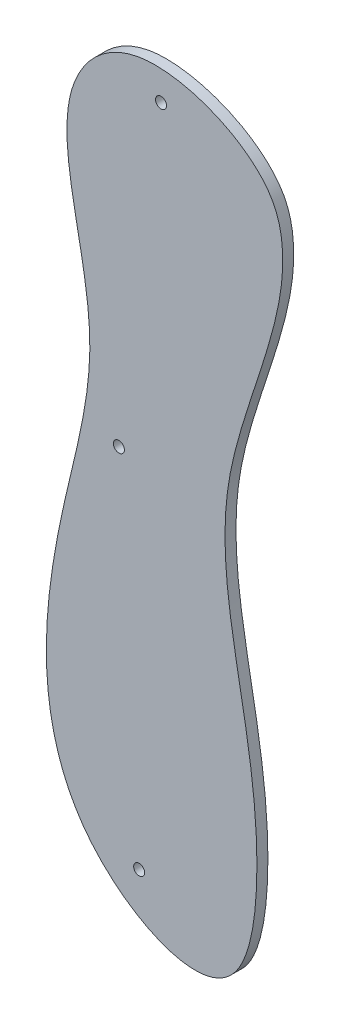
SolidWorks part; units mm, degrees
ref_plane "Front Plane" through (0, 0, 0) normal (0, 0, 1) x (1, 0, 0)
ref_plane "Top Plane" through (0, 0, 0) normal (0, 1, 0) x (1, 0, 0)
ref_plane "Right Plane" through (0, 0, 0) normal (1, 0, 0) x (0, 0, -1)
sketch "Sketch1" plane through (0, 0, 0) normal (0, 0, 1) x (1, 0, 0)
  line L0 (0, 0) -> (0, 177.8) construction
  circle A0 centre (6.3287, 169.5683) radius 1.5875
  circle A1 centre (-5.8522, 77.2778) radius 1.5875
  circle A2 centre (0, -25.7354) radius 1.5875
  spline S0 degree 3 poles (37.5278, 170.2054) (-1.1415, 185.6015) (-29.8693, 154.7813) (-7.6532, 106.335) (-27.1121, 40.3524) (-32.8006, -26.0547) (31.7437, -55.2962) (37.0623, 21.1596) (12.7066, 75.7714) (45.4441, 135.7305) (37.5278, 170.2054) (-1.1415, 185.6015) (-29.8693, 154.7813) knots -0.226019 -0.102427 -0.079825 0 0.060054 0.182191 0.264366 0.430401 0.544581 0.61493 0.773981 0.897573 0.920175 1 1.060054 1.182191 1.264366 only from (0, 177.8) to (0, 177.8)
  point P16 (-14.2669, 99.3835)
  point P18 (-13.9568, -25.7354)
  point P19 (-19.2286, 160.7847)
  dimension "D2" = 3.175
  dimension "D1" = 177.8
extrude "Boss-Extrude1" add sketch "Sketch1" along normal blind 3.175
